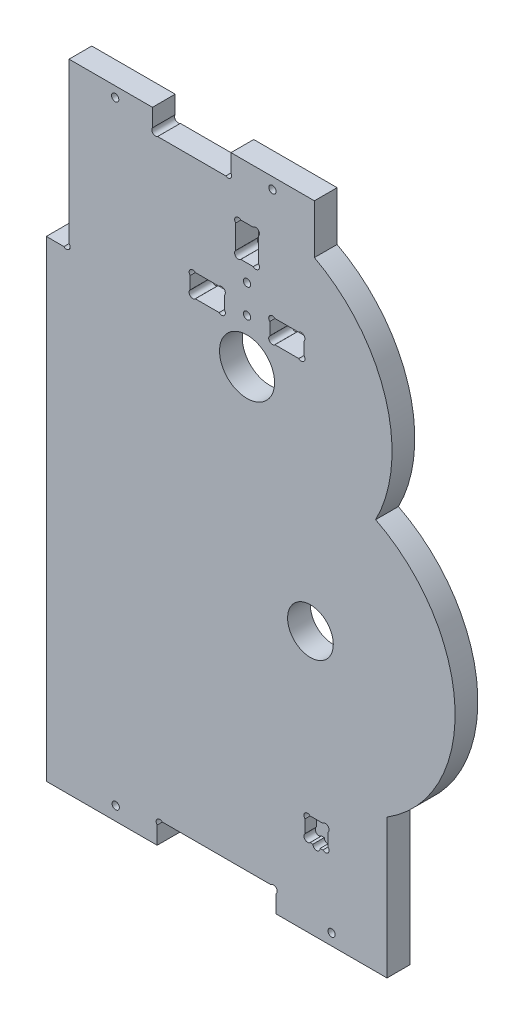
SolidWorks part; units mm, degrees
ref_plane "Plan de face" through (0, 0, 0) normal (0, 0, 1) x (1, 0, 0)
ref_plane "Plan de dessus" through (0, 0, 0) normal (0, 1, 0) x (1, 0, 0)
ref_plane "Plan de droite" through (0, 0, 0) normal (1, 0, 0) x (0, 0, -1)
sketch "Esquisse1" plane through (0, 0, 0) normal (0, 0, 1) x (1, 0, 0)
  line L0 (24.8582, -223.9378) -> (34.8582, -223.9378)
  line L1 (2.9225, 56.0622) -> (-114.9612, 56.0622)
  line L2 (1.0499, -189.2658) -> (2.2621, -189.2658)
  line L3 (-1.2129, -187.003) -> (-1.2129, -181.3785)
  line L4 (1.0499, -179.1158) -> (6.6744, -179.1158)
  line L5 (3.8621, -179.1158) -> (3.8621, -194.2208) construction
  line L6 (-1.2129, -184.1908) -> (11.3172, -184.1908) construction
  line L7 (-1.2129, -179.1158) -> (1.94, -182.2687) construction
  line L8 (5.4621, -189.2658) -> (6.6744, -189.2658)
  line L9 (8.9371, -187.003) -> (8.9371, -181.3785)
  line L10 (2.9225, 56.0622) -> (2.9225, 34.4251)
  line L11 (-26.6956, -50.7932) -> (-26.6956, 39.0553) construction
  line L12 (-114.9612, 56.0622) -> (-114.9612, -223.9378)
  line L13 (51.5445, -21.9378) -> (-34.7411, -21.9378) construction
  line L14 (51.5445, -7.4378) -> (-64.6842, -7.4378) construction
  line L15 (51.5445, 2.5622) -> (-64.6842, 2.5622) construction
  line L16 (34.8582, -223.9378) -> (34.8582, -162.6556)
  line L17 (-51.6956, -50.7932) -> (-51.6956, 25.331) construction
  line L18 (-44.1956, -40.2826) -> (-44.1956, 6.5064) construction
  line L19 (40.8284, -2.4378) -> (-32.3844, -2.4378) construction
  line L20 (-51.6956, -7.4378) -> (-33.62, 10.6378) construction
  line L21 (-36.6956, -5.1751) -> (-36.6956, 0.2994)
  line L22 (-38.9584, 2.5622) -> (-49.4329, 2.5622)
  line L23 (-51.6956, -5.1751) -> (-51.6956, 0.2994)
  line L24 (-38.9584, -7.4378) -> (-49.4329, -7.4378)
  line L25 (-14.4329, -7.4378) -> (-3.9584, -7.4378)
  line L26 (-1.6956, -5.1751) -> (-1.6956, 0.2994)
  line L27 (-14.4329, 2.5622) -> (-3.9584, 2.5622)
  line L28 (-16.6956, -5.1751) -> (-16.6956, 0.2994)
  line L29 (51.5445, 32.5622) -> (-64.6842, 32.5622) construction
  line L30 (-31.6956, 47.8707) -> (-31.6956, 0.2994) construction
  line L31 (-21.6956, 47.8707) -> (-21.6956, 0.2994) construction
  line L32 (40.8284, 17.5622) -> (-38.9584, 17.5622) construction
  line L33 (-24.2709, 25.0622) -> (-47.1568, 25.0622) construction
  line L34 (-13.3302, 10.0622) -> (-29.2131, 10.0622) construction
  line L35 (-31.6956, 17.5622) -> (-16.6956, 32.5622) construction
  line L36 (-23.9584, 32.5622) -> (-29.4329, 32.5622)
  line L37 (-31.6956, 30.2994) -> (-31.6956, 19.8249)
  line L38 (-29.4329, 17.5622) -> (-23.9584, 17.5622)
  line L39 (-21.6956, 19.8249) -> (-21.6956, 30.2994)
  line L43 (24.8582, -223.9378) -> (-114.9612, -223.9378)
  arc A0 (29.8582, -51.9094) -> (2.9225, 34.4251) centre (-27.1851, -22.3373) ccw
  circle A1 centre (1.1888, -108.6898) radius 10.05
  arc A2 (-1.2129, -181.3785) -> (1.0499, -179.1158) centre (-0.0815, -180.2471) cw
  circle A3 centre (-26.6956, -21.9378) radius 12.1
  arc A4 (8.9371, -181.3785) -> (6.6744, -179.1158) centre (7.8057, -180.2471) ccw
  arc A5 (8.9371, -187.003) -> (6.6744, -189.2658) centre (7.8057, -188.1344) cw
  arc A6 (34.8582, -162.6556) -> (29.8582, -51.9094) centre (1.1888, -108.6898) ccw
  arc A7 (-1.2129, -187.003) -> (1.0499, -189.2658) centre (-0.0815, -188.1344) ccw
  arc A8 (2.2621, -189.2658) -> (5.4621, -189.2658) centre (3.8621, -189.2658) ccw
  arc A9 (-51.6956, -5.1751) -> (-49.4329, -7.4378) centre (-50.5642, -6.3065) ccw
  arc A10 (-51.6956, 0.2994) -> (-49.4329, 2.5622) centre (-50.5642, 1.4308) cw
  arc A11 (-36.6956, 0.2994) -> (-38.9584, 2.5622) centre (-37.827, 1.4308) ccw
  arc A12 (-36.6956, -5.1751) -> (-38.9584, -7.4378) centre (-37.827, -6.3065) cw
  arc A13 (-16.6956, -5.1751) -> (-14.4329, -7.4378) centre (-15.5642, -6.3065) ccw
  arc A14 (-16.6956, 0.2994) -> (-14.4329, 2.5622) centre (-15.5642, 1.4308) cw
  arc A15 (-1.6956, 0.2994) -> (-3.9584, 2.5622) centre (-2.827, 1.4308) ccw
  arc A16 (-1.6956, -5.1751) -> (-3.9584, -7.4378) centre (-2.827, -6.3065) cw
  circle A17 centre (-26.6956, -2.4378) radius 1.6
  circle A18 centre (-26.6956, 10.0622) radius 1.6
  arc A19 (-31.6956, 19.8249) -> (-29.4329, 17.5622) centre (-30.5642, 18.6935) ccw
  arc A20 (-21.6956, 19.8249) -> (-23.9584, 17.5622) centre (-22.827, 18.6935) cw
  arc A21 (-31.6956, 30.2994) -> (-29.4329, 32.5622) centre (-30.5642, 31.4308) cw
  arc A22 (-21.6956, 30.2994) -> (-23.9584, 32.5622) centre (-22.827, 31.4308) ccw
  point P13 (-0.0815, -180.2471)
  dimension "D6" = 280
  dimension "D7" = 63.6077
  dimension "D8" = 1.6
  dimension "D2" = 14.5
  dimension "D11" = 0
  dimension "D16" = 5
  dimension "D12" = 7.5
  dimension "D10" = 10
  dimension "D15" = 30
  dimension "D3" = 139.8194
  dimension "D4" = 25
  dimension "D5" = 45
  dimension "D9" = 90
  dimension "D13" = 5
  dimension "D14" = 45
  dimension "D17" = 10
  dimension "D18" = 15
  dimension "D19" = 7.5
  dimension "D20" = 7.5
  dimension "D21" = 45
extrude "Boss.-Extru.1" add sketch "Esquisse1" along normal blind 10
sketch "Esquisse11" plane through (0, 0, 10) normal (0, 0, 1) x (1, 0, 0)
  line L0 (-13.8918, -213.9378) -> (-23.8702, -223.9162) construction
  line L1 (2.9225, 56.0622) -> (-114.9612, 56.0622) construction
  line L3 (-33.7556, 56.0622) -> (-68.2812, 56.0622)
  line L5 (-114.9612, 56.0622) -> (-114.9612, -223.9378) construction
  line L6 (-33.7556, 56.0622) -> (-33.7556, 48.2513)
  line L7 (-13.8918, -223.9378) -> (-66.2112, -223.9378)
  line L8 (-13.8918, -223.9378) -> (-13.8918, -216.2006)
  line L9 (-16.1546, -213.9378) -> (-63.9484, -213.9378)
  line L12 (-36.0184, 46.0622) -> (-66.0184, 46.0622)
  line L13 (-68.2812, 56.0622) -> (-68.2812, 48.2513)
  line L14 (-114.9612, 56.0622) -> (-114.9612, -223.9378) construction
  line L16 (-66.2112, -223.9378) -> (-66.2112, -216.2006)
  line L17 (-66.2112, -213.9378) -> (-40.6634, -239.4856) construction
  line L18 (-33.9546, 46.231) -> (-42.7807, 55.0571) construction
  line L19 (-51.0184, 56.0622) -> (-51.0184, 38.6839) construction
  arc A0 (-63.9484, -213.9378) -> (-66.2112, -216.2006) centre (-65.0798, -215.0692) ccw
  arc A1 (-36.0184, 46.0622) -> (-33.7556, 48.2513) centre (-35.0859, 47.3624) ccw
  arc A2 (-66.0184, 46.0622) -> (-68.2812, 48.2513) centre (-66.9509, 47.3624) cw
  arc A3 (-13.8918, -216.2006) -> (-16.1546, -213.9378) centre (-15.0232, -215.0692) ccw
  point P1 (-15.0232, -215.0692)
  point P11 (-65.0798, -215.0692)
  point P23 (-35.0859, 47.3624)
  dimension "D5" = 45
  dimension "D7" = 46.68
  dimension "D9" = 30
  dimension "D8" = 50.0566
  dimension "D6" = 1.6
  dimension "D13" = 10
  dimension "D2" = 45
  dimension "D3" = 10
  dimension "D4" = 48.75
  dimension "D10" = 1.6
  dimension "D11" = 45
  dimension "D12" = 1.6
extrude "Enlèv. mat.-Extru.7" cut sketch "Esquisse11" against normal blind 10
sketch "Esquisse13" plane through (0, 0, 0) normal (0, 0, -1) x (-1, 0, 0)
  line L0 (114.9612, -83.9378) -> (-132.2715, -83.9378) construction
  line L1 (104.9612, -16.4378) -> (123.4887, 2.0896) construction
  line L4 (114.9612, -16.4378) -> (107.2239, -16.4378)
  line L5 (114.9612, 56.0622) -> (114.9612, -223.9378) construction
  line L6 (104.9612, 56.0622) -> (104.9612, -14.1751)
  arc A0 (107.2239, -16.4378) -> (104.9612, -14.1751) centre (106.0925, -15.3065) cw
  point P9 (106.0925, -15.3065)
  dimension "D2" = 10
  dimension "D3" = 45
  dimension "D4" = 1.6
extrude "Enlèv. mat.-Extru.8" cut sketch "Esquisse13" against normal through all
sketch "Esquisse14" plane through (0, 0, 0) normal (0, 0, -1) x (-1, 0, 0)
  line L3 (13.8918, -213.9378) -> (-34.8582, -223.9378) construction
  line L4 (13.8918, -223.9378) -> (-34.8582, -213.9378) construction
  line L5 (-34.8582, -223.9378) -> (-34.8582, -162.6556) construction
  line L6 (33.9734, 46.2124) -> (-2.9225, 56.0622) construction
  circle A3 centre (84.6764, 51.5913) radius 1.6
  circle A5 centre (84.4275, -217.9409) radius 1.6
  arc A6 (16.1546, -213.9378) -> (13.8918, -216.2006) centre (15.0232, -215.0692) ccw construction
  circle A7 centre (-10.4832, -218.9378) radius 1.6
  arc A8 (33.7556, 48.2513) -> (36.0184, 46.0622) centre (35.0859, 47.3624) ccw construction
  circle A9 centre (15.5254, 51.1373) radius 1.6
extrude "Enlèv. mat.-Extru.9" cut sketch "Esquisse14" against normal blind 10
sketch "Esquisse15" plane through (0, 0, 0) normal (0, 0, -1) x (-1, 0, 0)
  line L1 (-12.7253, -176.467) -> (8.3674, -176.467)
  line L2 (-12.7253, -176.467) -> (-12.7253, -196.3657)
  line L3 (-12.7253, -196.3657) -> (8.3674, -196.3657)
  line L4 (8.3674, -176.467) -> (8.3674, -196.3657)
extrude "Boss.-Extru.2" add sketch "Esquisse15" against normal blind 5
